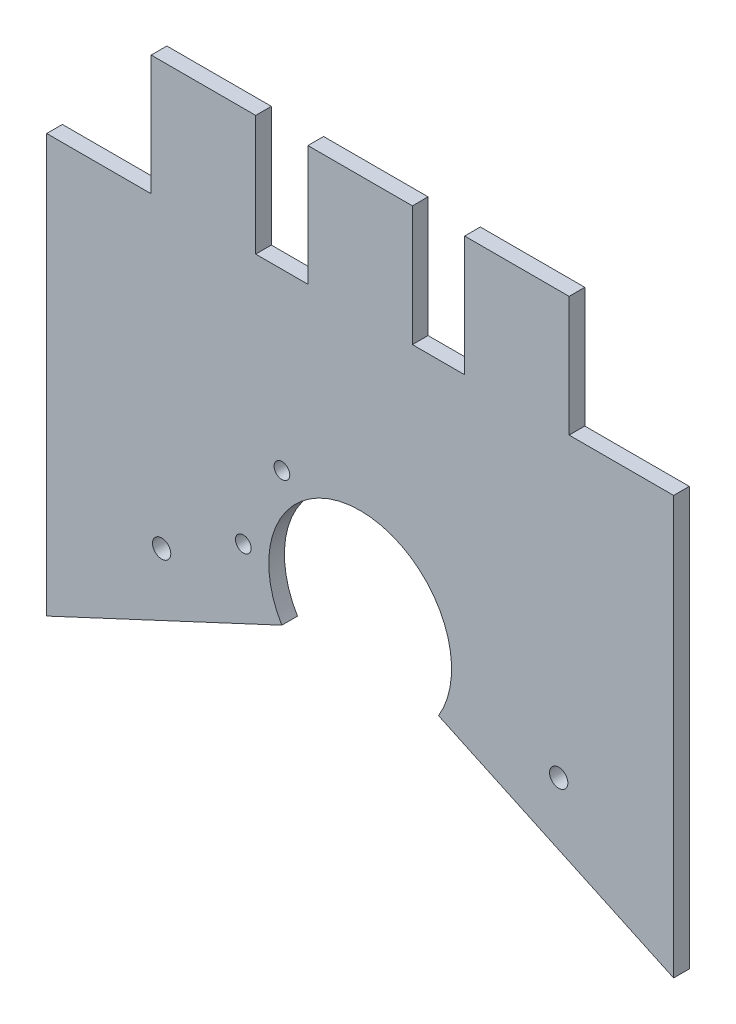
SolidWorks part; units mm, degrees
ref_plane "Plan de face" through (0, 0, 0) normal (0, 0, 1) x (1, 0, 0)
ref_plane "Plan de dessus" through (0, 0, 0) normal (0, 1, 0) x (1, 0, 0)
ref_plane "Plan de droite" through (0, 0, 0) normal (1, 0, 0) x (0, 0, -1)
sketch "Esquisse1" plane through (0, 0, 0) normal (0, 0, 1) x (1, 0, 0)
  line L0 (-10, 0) -> (10, 0)
  line L1 (10, 0) -> (10, -23)
  line L2 (10, -23) -> (20, -23)
  line L3 (20, -23) -> (20, 0)
  line L4 (20, 0) -> (40, 0)
  line L5 (40, 0) -> (40, -23)
  line L6 (40, -23) -> (60, -23)
  line L7 (60, -23) -> (60, -80.8)
  line L8 (60, -80.8) -> (38, -80.8) construction
  line L9 (0, 0) -> (0, -83) construction
  line L11 (-60, -23) -> (-60, -80.8)
  line L12 (-40, -23) -> (-60, -23)
  line L13 (-40, 0) -> (-40, -23)
  line L14 (-20, 0) -> (-40, 0)
  line L15 (-20, -23) -> (-20, 0)
  line L16 (-10, -23) -> (-20, -23)
  line L17 (-10, 0) -> (-10, -23)
  line L18 (-60, -80.8) -> (-60, -103)
  line L20 (60, -103) -> (60, -80.8)
  line L21 (0, 0) -> (0, -73)
  line L22 (0, -73) -> (-30.3129, -73) construction
  line L23 (0, -73) -> (-45.5889, -51.7416) construction
  line L24 (0, -73) -> (-18.6699, -64.2941) construction
  line L25 (-18.6699, -64.2941) -> (-14.972, -56.3639) construction
  line L26 (-18.6699, -64.2941) -> (-22.3679, -72.2243) construction
  line L27 (-60, -103) -> (-14.9989, -82.0157)
  line L28 (14.9989, -82.0157) -> (60, -103)
  line L29 (0, -73) -> (0, -80.8) construction
  line L30 (0, -80.8) -> (-38, -80.8) construction
  circle A0 centre (38, -80.8) radius 1.75
  circle A1 centre (-38, -80.8) radius 1.75
  circle A2 centre (-22.3679, -72.2243) radius 1.5
  circle A3 centre (-14.972, -56.3639) radius 1.5
  arc A4 (14.9989, -82.0157) -> (-14.9989, -82.0157) centre (0, -73) ccw
  point P33 (0, 0)
  point P38 (0, 0)
  point P39 (0, 0)
  dimension "D9" = 3.5
  dimension "D17" = 3
  dimension "D18" = 3
  dimension "D19" = 35
  dimension "D1" = 10
  dimension "D2" = 10
  dimension "D3" = 23
  dimension "D4" = 23
  dimension "D5" = 20
  dimension "D6" = 20
  dimension "D7" = 57.8
  dimension "D8" = 22
  dimension "D11" = 73
  dimension "D12" = 25
  dimension "D13" = 20.6
  dimension "D14" = 8.75
  dimension "D15" = 8.75
  dimension "D16" = 90
  dimension "D20" = 65
  dimension "D21" = 65
  dimension "D23" = 7.8
  dimension "D24" = 38
extrude "Boss.-Extru.1" add sketch "Esquisse1" along normal blind 3 contours A4 L21 L0 L17 L16 L15 L14 L13 L12 L11 L18 L27 A1 A2 A3 | A4 L28 L20 L7 L6 L5 L4 L3 L2 L1 L0 L21 A0
